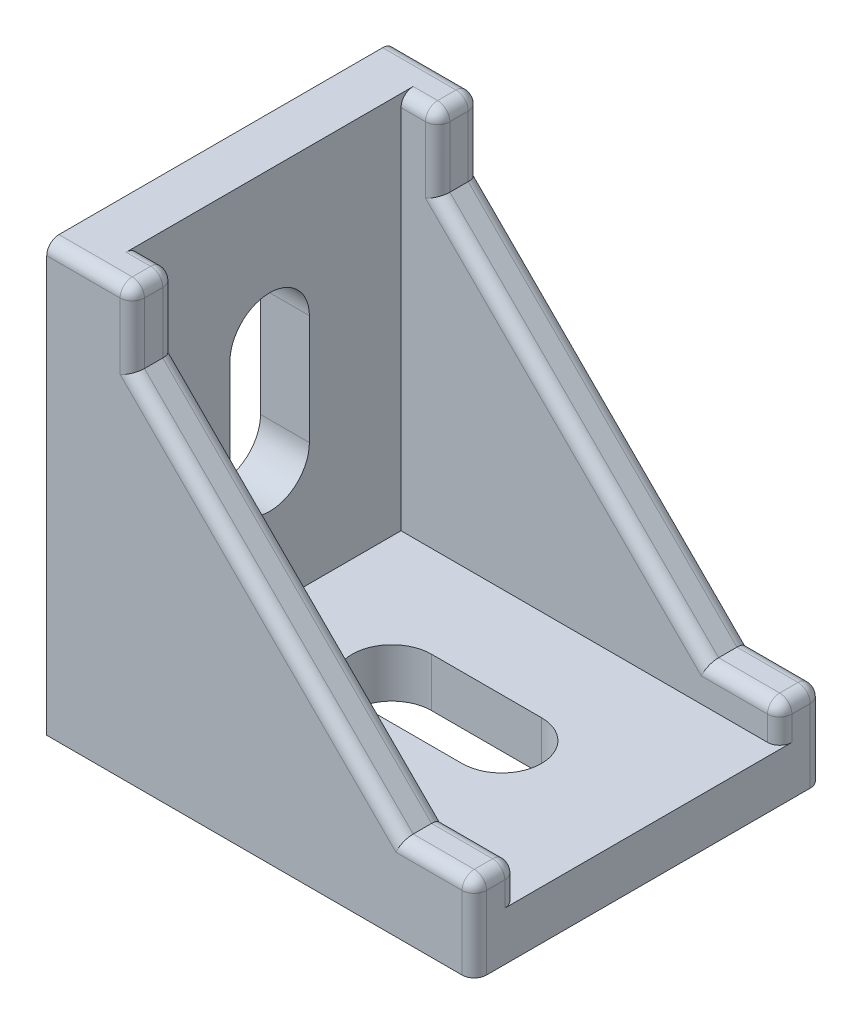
SolidWorks part; units mm, degrees
ref_plane "前视基准面" through (0, 0, 0) normal (0, 0, 1) x (1, 0, 0)
ref_plane "上视基准面" through (0, 0, 0) normal (0, 1, 0) x (1, 0, 0)
ref_plane "右视基准面" through (0, 0, 0) normal (1, 0, 0) x (0, 0, -1)
sketch "草图1" plane through (0, 0, 0) normal (0, 0, 1) x (1, 0, 0)
  line L0 (-35, 7.6766) -> (-31, 7.6766)
  line L1 (-31, 7.6766) -> (-31, -23.3234)
  line L2 (-31, -23.3234) -> (0, -23.3234)
  line L3 (0, -23.3234) -> (0, -27.3234)
  line L4 (-35, 7.6766) -> (-35, -27.3234)
  line L5 (-35, -27.3234) -> (0, -27.3234)
  dimension "D1" = 31
  dimension "D2" = 35
  dimension "D3" = 35
  dimension "D4" = 4
  dimension "D5" = 4
extrude "凸台-拉伸1" add sketch "草图1" along normal blind 25
sketch "草图2" plane through (0, 0, 25) normal (0, 0, 1) x (1, 0, 0)
  line L0 (-31, 7.6766) -> (-28, 7.6766)
  line L1 (-28, 7.6766) -> (-28, 1.6766)
  line L2 (-28, 1.6766) -> (-6, -20.3234)
  line L3 (-6, -20.3234) -> (0, -20.3234)
  line L4 (0, -20.3234) -> (0, -23.3234)
  line L5 (0, -23.3234) -> (-31, -23.3234)
  line L6 (-31, -23.3234) -> (-31, 7.6766)
  dimension "D1" = 3
  dimension "D2" = 3
  dimension "D3" = 6
  dimension "D4" = 6
extrude "凸台-拉伸2" add sketch "草图2" against normal blind 3.5
ref_plane "基准面1" through (0, 0, 10.75) normal (0, 0, 1) x (1, 0, 0)
mirror "镜向4" about plane through (0, 0, 10.75) normal (0, 0, 1) of "凸台-拉伸1", "凸台-拉伸2"
sketch "草图4" plane through (-31, 0, 0) normal (1, 0, 0) x (0, 0, -1)
  line L0 (-10.75, 7.6766) -> (-10.75, -23.3234)
  line L1 (-21.5, 7.6766) -> (0, 7.6766) construction
  line L2 (-21.5, -23.3234) -> (0, -23.3234) construction
  line L3 (-10.75, -4.3234) -> (-10.75, -13.3234) construction
  line L4 (-7.5, -4.3234) -> (-7.5, -13.3234)
  line L5 (-14, -4.3234) -> (-14, -13.3234)
  arc A0 (-7.5, -4.3234) -> (-14, -4.3234) centre (-10.75, -4.3234) ccw
  arc A1 (-14, -13.3234) -> (-7.5, -13.3234) centre (-10.75, -13.3234) ccw
  point P8 (-10.75, -8.8234)
  dimension "D2" = 3.25
  dimension "D1" = 9
  dimension "D3" = 12
extrude "切除-拉伸1" cut sketch "草图4" against normal through all contours L5 A1 L0 A0 | L0 A1 L4 A0
sketch "草图5" plane through (-35, 0, 0) normal (-1, 0, 0) x (0, 0, 1)
  line L0 (6.85, 4.6766) -> (14.65, 4.6766)
  line L1 (14.65, 4.6766) -> (14.65, 2.6766)
  line L2 (14.65, 2.6766) -> (6.85, 2.6766)
  line L3 (6.85, 4.6766) -> (6.85, 2.6766)
  line L5 (-3.5, 7.6766) -> (-3.5, -27.3234) construction
  line L6 (25, 7.6766) -> (-3.5, 7.6766) construction
  dimension "D1" = 2
  dimension "D2" = 7.8
  dimension "D3" = 10.35
  dimension "D4" = 3
extrude "凸台-拉伸3" add sketch "草图5" along normal blind 2
sketch "草图6" plane through (-35, 0, 0) normal (-1, 0, 0) x (0, 0, 1)
  line L0 (6.85, -22.8234) -> (14.65, -22.8234)
  line L1 (14.65, -22.8234) -> (14.65, -24.8234)
  line L2 (14.65, -24.8234) -> (6.85, -24.8234)
  line L3 (6.85, -24.8234) -> (6.85, -22.8234)
  line L4 (-3.5, 7.6766) -> (-3.5, -27.3234) construction
  line L5 (25, -27.3234) -> (-3.5, -27.3234) construction
  dimension "D1" = 2
  dimension "D2" = 7.8
  dimension "D3" = 10.35
  dimension "D4" = 2.5
extrude "凸台-拉伸4" add sketch "草图6" along normal blind 2
sketch "草图7" plane through (-35, 0, 0) normal (-1, 0, 0) x (0, 0, 1)
  line L0 (6.85, 4.6766) -> (4.5, 4.6766)
  line L1 (4.5, 4.6766) -> (4.5, -0.3234)
  line L2 (4.5, -0.3234) -> (17, -0.3234)
  line L3 (17, -0.3234) -> (17, 4.6766)
  line L4 (17, 4.6766) -> (14.65, 4.6766)
  line L5 (14.65, 4.6766) -> (14.65, 2.6766)
  line L6 (14.65, 2.6766) -> (6.85, 2.6766)
  line L7 (6.85, 2.6766) -> (6.85, 4.6766)
  line L8 (-3.5, 7.6766) -> (-3.5, -27.3234) construction
  line L9 (25, 7.6766) -> (25, -27.3234) construction
  line L11 (25, 7.6766) -> (-3.5, 7.6766) construction
  dimension "D1" = 8
  dimension "D2" = 8
  dimension "D3" = 5
  dimension "D4" = 3
  dimension "D5" = 3
extrude "切除-拉伸2" cut sketch "草图7" against normal blind 2
sketch "草图8" plane through (-35, 0, 0) normal (-1, 0, 0) x (0, 0, 1)
  line L0 (14.65, -24.8234) -> (17, -24.8234)
  line L1 (17, -24.8234) -> (17, -19.8234)
  line L2 (17, -19.8234) -> (4.5, -19.8234)
  line L3 (4.5, -19.8234) -> (4.5, -24.8234)
  line L4 (4.5, -24.8234) -> (6.85, -24.8234)
  line L5 (6.85, -24.8234) -> (14.65, -24.8234) construction
  line L6 (6.85, -24.8234) -> (6.85, -22.8234)
  line L7 (6.85, -22.8234) -> (14.65, -22.8234)
  line L8 (14.65, -22.8234) -> (14.65, -24.8234)
  line L11 (-3.5, 7.6766) -> (-3.5, -27.3234) construction
  line L12 (25, 7.6766) -> (25, -27.3234) construction
  dimension "D1" = 5
  dimension "D2" = 8
  dimension "D3" = 8
extrude "切除-拉伸3" cut sketch "草图8" against normal blind 2
ref_plane "基准面10" through (-3.8383, 3.8383, 0) normal (0.7071, -0.7071, 0) x (0.7071, 0.7071, 0)
mirror "镜向5" about plane through (-3.8383, 3.8383, 0) normal (0.7071, -0.7071, 0) of "凸台-拉伸4", "切除-拉伸3", "切除-拉伸2", "凸台-拉伸3"
mirror "镜向6" about plane through (-3.8383, 3.8383, 0) normal (0.7071, -0.7071, 0) of "切除-拉伸1"
fillet "圆角1" radius 1 1 edges at (-17, -9.3234, 25)
fillet "圆角2" radius 1 1 edges at (-17, -9.3234, 21.5)
fillet "圆角3" radius 1 1 edges at (-3.7071, -20.3234, 25)
fillet "圆角4" radius 1 1 edges at (-3.7071, -20.3234, 21.5)
fillet "圆角5" radius 1 5 edges at (0, -22.3234, 21.5) (0, -20.6163, 21.7929) (0, -20.3234, 23.25) (0, -20.6163, 24.7071) (0, -24.3234, 25)
fillet "圆角6" radius 1 1 edges at (-28, 7.6766, 23.25)
fillet "圆角7" radius 1 3 edges at (-32, 7.6766, 25) (-28.2929, 7.3837, 25) (-28, 3.4694, 25)
fillet "圆角8" radius 1 3 edges at (-30, 7.6766, 21.5) (-28.2929, 7.3837, 21.5) (-28, 3.4694, 21.5)
fillet "圆角9" radius 1 1 edges at (-31.5, 7.6766, -3.5)
fillet "圆角10" radius 1 1 edges at (-29.5, 7.6766, 0)
fillet "圆角11" radius 1 5 edges at (-28, 4.1766, -3.5) (-28, 7.3837, -3.2071) (-28, 7.6766, -1.75) (-28, 7.3837, -0.2929) (-28, 4.1766, 0)
fillet "圆角12" radius 1 1 edges at (-17.5, -8.8234, 0)
fillet "圆角13" radius 1 1 edges at (-17.5, -8.8234, -3.5)
fillet "圆角14" radius 1 1 edges at (-3.7071, -20.3234, 0)
fillet "圆角15" radius 1 1 edges at (-3.7071, -20.3234, -3.5)
fillet "圆角16" radius 1 5 edges at (0, -24.3234, -3.5) (0, -22.3234, 0) (0, -20.6163, -0.2929) (0, -20.3234, -1.75) (0, -20.6163, -3.2071)
fillet "圆角17" radius 0.5 1 edges at (-3, -29.3234, 10.75)
fillet "圆角18" radius 0.5 1 edges at (-5, -29.3234, 10.75)
fillet "圆角19" radius 0.5 1 edges at (-32.5, -29.3234, 10.75)
fillet "圆角20" radius 0.5 1 edges at (-30.5, -29.3234, 10.75)
fillet "圆角21" radius 0.5 1 edges at (-37, -22.8234, 10.75)
fillet "圆角22" radius 0.5 1 edges at (-37, -24.8234, 10.75)
fillet "圆角23" radius 0.5 1 edges at (-37, 4.6766, 10.75)
fillet "圆角24" radius 0.5 1 edges at (-37, 2.6766, 10.75)
